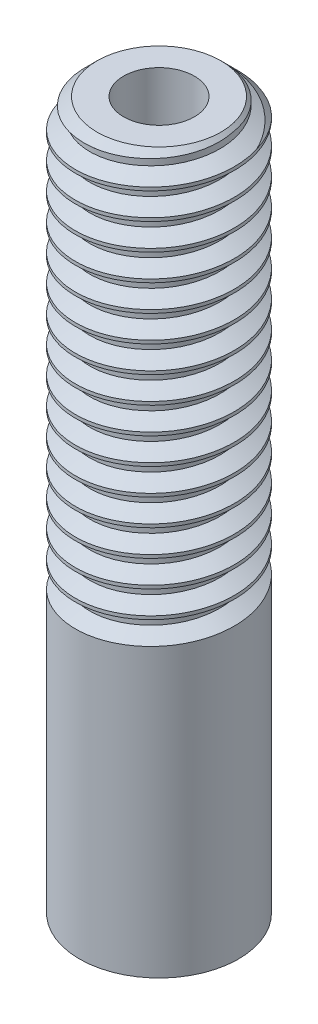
SolidWorks part; units mm, degrees
ref_plane "Спереди" through (0, 0, 0) normal (0, 0, 1) x (1, 0, 0)
ref_plane "Сверху" through (0, 0, 0) normal (0, 1, 0) x (1, 0, 0)
ref_plane "Справа" through (0, 0, 0) normal (1, 0, 0) x (0, 0, -1)
other "Configuration Table"
sketch "Эскиз1" plane through (0, 0, 0) normal (0, 1, 0) x (1, 0, 0)
  circle A0 centre (-5.4621, 0.2544) radius 4.5
  circle A1 centre (-5.4621, 0.2544) radius 2
  dimension "D1" = 4
  dimension "D2" = 9
extrude "Бобышка-Вытянуть1" add sketch "Эскиз1" along normal blind 40
chamfer "Фаска1" distance 1 angle 45 1 edges at (-5.4621, 40, 4.2456)
thread "Резьба1" pitch 1.5 start angle 0, offset 2, length 24, pitch 1.5, diameter 9
ref_plane "Плоскость1" through (-9.9621, 41, -0.2544) normal (0, 0, 1) x (-1, 0, 0)
sketch "Профиль резьбы1" plane through (-9.9621, 41, -0.2544) normal (0, 0, 1) x (-1, 0, 0)
  line L0 (0, 0) -> (0, 1.5) construction
  line L11 (0, 0) -> (0, 1.3125)
  line L12 (0, 1.3125) -> (-0.8119, 0.8437)
  line L13 (-0.8119, 0.8437) -> (-0.8119, 0.4687)
  line L15 (-0.8119, 0.4687) -> (0, 0)
  line L17 (-0.8119, 0.6562) -> (0, 0.6562) construction
  point P2 (0, 0)
  dimension "Pitch" = 1.5
  dimension "Profile_Angle" = 60
  dimension "Profile_Land" = 0.375
  dimension "Profile_Height" = 0.8119
